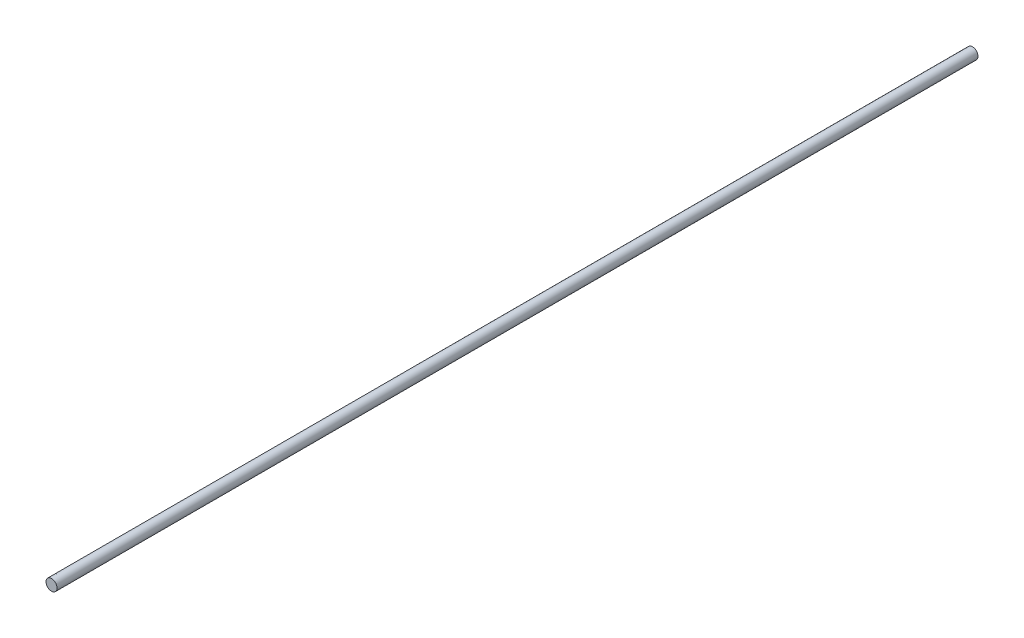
SolidWorks part; units mm, degrees
ref_plane "Plan de face" through (0, 0, 0) normal (0, 0, 1) x (1, 0, 0)
ref_plane "Plan de dessus" through (0, 0, 0) normal (0, 1, 0) x (1, 0, 0)
ref_plane "Plan de droite" through (0, 0, 0) normal (1, 0, 0) x (0, 0, -1)
sketch "Esquisse1" plane through (0, 0, 0) normal (0, 0, 1) x (1, 0, 0)
  circle A0 centre (0, 0) radius 1.5
  dimension "D1" = 3
extrude "Boss.-Extru.1" add sketch "Esquisse1" along normal blind 250
